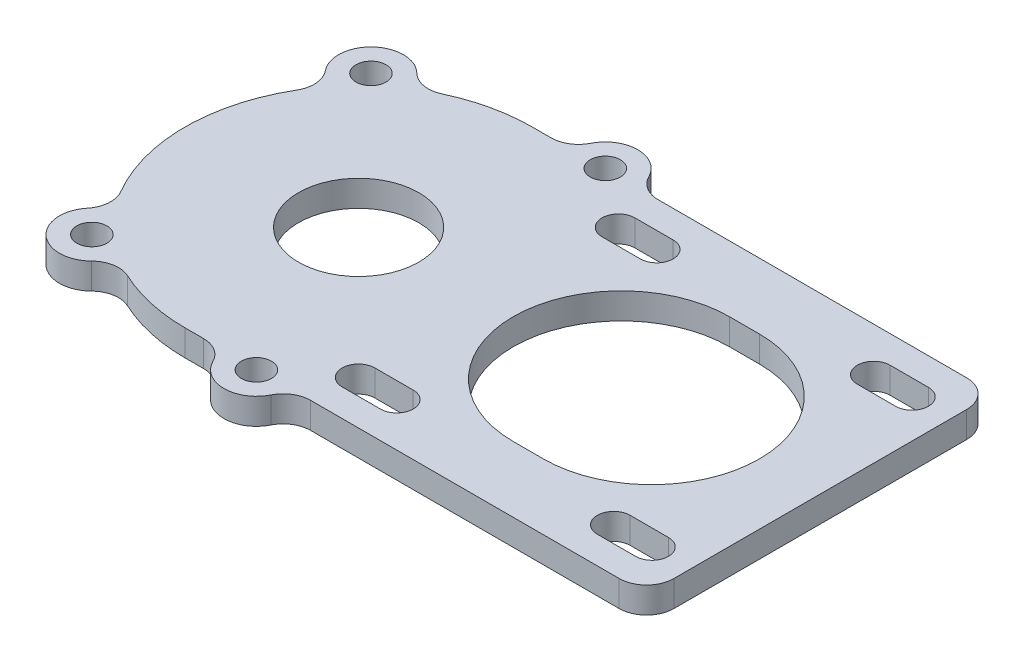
SolidWorks part; units mm, degrees
ref_plane "Front Plane" through (0, 0, 0) normal (0, 0, 1) x (1, 0, 0)
ref_plane "Top Plane" through (0, 0, 0) normal (0, 1, 0) x (1, 0, 0)
ref_plane "Right Plane" through (0, 0, 0) normal (1, 0, 0) x (0, 0, -1)
sketch "Sketch1" plane through (0, 0, 0) normal (0, 1, 0) x (1, 0, 0)
  line L0 (26.2875, 0) -> (20.7875, 0) construction
  line L1 (-27.2125, -31.75) -> (-19.9364, -31.75)
  line L2 (-57.15, 31.75) -> (-57.15, -31.75) construction
  line L3 (-27.2125, 31.75) -> (-19.9364, 31.75)
  line L4 (57.15, -31.75) -> (57.15, 31.75)
  line L5 (-57.15, -31.75) -> (57.15, 31.75) construction
  line L6 (-57.15, 31.75) -> (57.15, -31.75) construction
  line L7 (26.2875, -19.75) -> (20.7875, -19.75)
  line L8 (26.2875, 19.75) -> (20.7875, 19.75)
  line L9 (-128.1867, 0) -> (128.1867, 0) construction
  line L10 (46.0375, 3.2291) -> (46.0375, -5.2084) construction
  line L11 (1.0375, 18.3161) -> (1.0375, -19.75) construction
  line L12 (-58.9625, 0) -> (-58.9625, 18.3161) construction
  line L13 (50.15, 23.75) -> (43.15, 23.75) construction
  line L14 (50.15, 20.75) -> (43.15, 20.75)
  line L15 (50.15, 26.75) -> (43.15, 26.75)
  line L16 (53.15, 23.75) -> (53.15, 16.6091) construction
  line L17 (40.15, 23.75) -> (40.15, 29.2781) construction
  line L18 (0, 0) -> (174.1043, 0) construction
  line L19 (50.15, -23.75) -> (43.15, -23.75) construction
  line L20 (23.5375, 19.75) -> (23.5375, -26.9397) construction
  line L21 (50.15, -20.75) -> (43.15, -20.75)
  line L22 (50.15, -26.75) -> (43.15, -26.75)
  line L23 (-46.6314, 0) -> (127.4728, 0) construction
  line L24 (3.5186, 23.75) -> (-3.4814, 23.75) construction
  line L25 (3.5186, 20.75) -> (-3.4814, 20.75)
  line L26 (3.5186, 26.75) -> (-3.4814, 26.75)
  line L27 (3.5186, -23.75) -> (-3.4814, -23.75) construction
  line L28 (3.5186, -20.75) -> (-3.4814, -20.75)
  line L29 (3.5186, -26.75) -> (-3.4814, -26.75)
  line L30 (-50.4504, 25.5) -> (-50.4504, -25.5) construction
  line L31 (-50.4504, -25.5) -> (-14.0127, -31.875) construction
  line L32 (-14.0127, -31.875) -> (-14.0127, 31.875) construction
  line L33 (-14.0127, 31.875) -> (-50.4504, 25.5) construction
  line L34 (0, -41.58) -> (0, 41.58) construction
  line L35 (-8.089, -31.75) -> (57.15, -31.75)
  line L36 (-8.089, 31.75) -> (57.15, 31.75)
  arc A0 (26.2875, -19.75) -> (26.2875, 19.75) centre (26.2875, 0) ccw
  arc A1 (20.7875, 19.75) -> (20.7875, -19.75) centre (20.7875, 0) ccw
  arc A2 (-27.2125, 31.75) -> (-44.6197, 26.5528) centre (-27.2125, 0) ccw
  circle A3 centre (-27.2125, 0) radius 11
  arc A4 (50.15, 20.75) -> (50.15, 26.75) centre (50.15, 23.75) ccw
  arc A5 (43.15, 26.75) -> (43.15, 20.75) centre (43.15, 23.75) ccw
  arc A6 (50.15, -20.75) -> (50.15, -26.75) centre (50.15, -23.75) cw
  arc A7 (43.15, -26.75) -> (43.15, -20.75) centre (43.15, -23.75) cw
  arc A8 (3.5186, 20.75) -> (3.5186, 26.75) centre (3.5186, 23.75) ccw
  arc A9 (-3.4814, 26.75) -> (-3.4814, 20.75) centre (-3.4814, 23.75) ccw
  arc A10 (3.5186, -20.75) -> (3.5186, -26.75) centre (3.5186, -23.75) cw
  arc A11 (-3.4814, -26.75) -> (-3.4814, -20.75) centre (-3.4814, -23.75) cw
  circle A12 centre (-14.0127, -31.875) radius 2.75
  circle A13 centre (-14.0127, 31.875) radius 2.75
  circle A14 centre (-50.4504, 25.5) radius 2.75
  circle A15 centre (-50.4504, -25.5) radius 2.75
  arc A16 (-8.089, 31.75) -> (-19.9364, 31.75) centre (-14.0127, 31.875) ccw
  arc A17 (-44.6197, 26.5528) -> (-52.0388, 19.7919) centre (-50.4504, 25.5) ccw
  arc A18 (-52.0388, -19.7919) -> (-44.6197, -26.5528) centre (-50.4504, -25.5) ccw
  arc A19 (-19.9364, -31.75) -> (-8.089, -31.75) centre (-14.0127, -31.875) ccw
  arc A20 (-52.0388, 19.7919) -> (-52.0388, -19.7919) centre (-27.2125, 0) ccw
  circle A21 centre (-50.4504, 25.5) radius 5.925 construction
  arc A22 (-44.6197, -26.5528) -> (-27.2125, -31.75) centre (-27.2125, 0) ccw
  circle A23 centre (-14.0127, 31.875) radius 5.925 construction
  circle A24 centre (-14.0127, -31.875) radius 5.925 construction
  circle A25 centre (-50.4504, -25.5) radius 5.925 construction
  point P0 (0, 0)
  point P8 (23.5375, 0)
  point P27 (46.65, 23.75)
  point P42 (46.65, -23.75)
  point P50 (0.0186, 23.75)
  point P59 (0.0186, -23.75)
  point P77 (-44.5254, 25.5)
  point P82 (-44.5254, -25.5)
  point P84 (-8.0877, 31.875)
  point P90 (-8.0877, -31.875)
  dimension "D3" = 11.1125
  dimension "D5" = 45
  dimension "D7" = 22
  dimension "D14" = 5.5
  dimension "D15" = 5.5
  dimension "D16" = 5.5
  dimension "D17" = 5.5
  dimension "D1" = 63.5
  dimension "D2" = 114.3
  dimension "D4" = 12
  dimension "D6" = 105
  dimension "D8" = 63.5
  dimension "D9" = 5
  dimension "D10" = 4
  dimension "D11" = 6
  dimension "D12" = 13
  dimension "D18" = 127.4728
  dimension "D19" = 46.6314
  dimension "D20" = 51
  dimension "D21" = 63.75
  dimension "D22" = 3.175
  dimension "D23" = 3.175
  dimension "D13" = 2
extrude "Boss-Extrude2" add sketch "Sketch1" along normal blind 4.7625
fillet "Fillet1" radius 5 10 edges at (57.15, 2.3813, 31.75) (57.15, 2.3813, -31.75) (-8.089, 2.3813, -31.75) (-19.9364, 2.3813, -31.75) (-44.6197, 2.3813, -26.5528) (-52.0388, 2.3813, -19.7919) (-52.0388, 2.3813, 19.7919) (-44.6197, 2.3813, 26.5528) (-19.9364, 2.3813, 31.75) (-8.089, 2.3813, 31.75)
sketch "Sketch4" plane through (0, 4.7625, 0) normal (0, 1, 0) x (-1, 0, 0)
  line L0 (-57.15, 0) -> (5.7417, 0) construction
  line L1 (-57.15, 26.75) -> (-57.15, -26.75) construction
